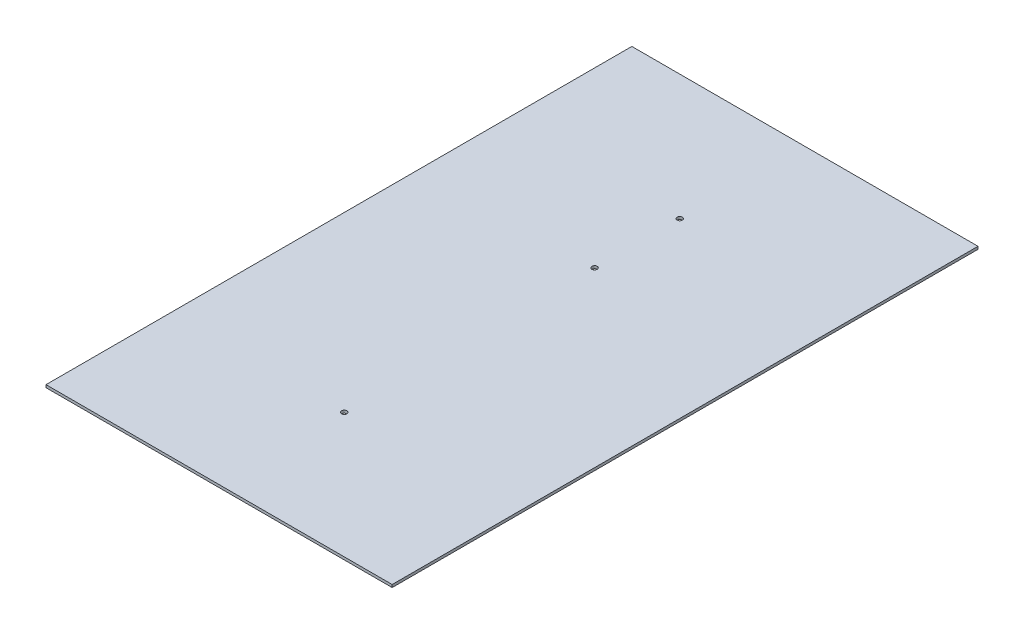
SolidWorks part; units mm, degrees
ref_plane "Front Plane" through (0, 0, 0) normal (0, 0, 1) x (1, 0, 0)
ref_plane "Top Plane" through (0, 0, 0) normal (0, 1, 0) x (1, 0, 0)
ref_plane "Right Plane" through (0, 0, 0) normal (1, 0, 0) x (0, 0, -1)
sketch "Эскиз1" plane through (0, 0, 0) normal (0, 1, 0) x (1, 0, 0)
  line L1 (-65, 110) -> (65, 110)
  line L2 (-65, 110) -> (-65, -110)
  line L3 (-65, -110) -> (65, -110)
  line L4 (65, 110) -> (65, -110)
  line L5 (-65, 110) -> (65, -110) construction
  line L6 (-65, -110) -> (65, 110) construction
  circle A0 centre (0, 63) radius 1
  circle A1 centre (0, 31) radius 1
  circle A2 centre (0, -63) radius 1
  point P0 (0, 0)
  dimension "D3" = 2
  dimension "D4" = 47
  dimension "D5" = 2
  dimension "D6" = 2
  dimension "D7" = 32
  dimension "D8" = 94
  dimension "D9" = 65
  dimension "D10" = 65
  dimension "D11" = 65
  dimension "D1" = 130
  dimension "D2" = 220
extrude "Бобышка-Вытянуть1" add sketch "Эскиз1" along normal blind 1
